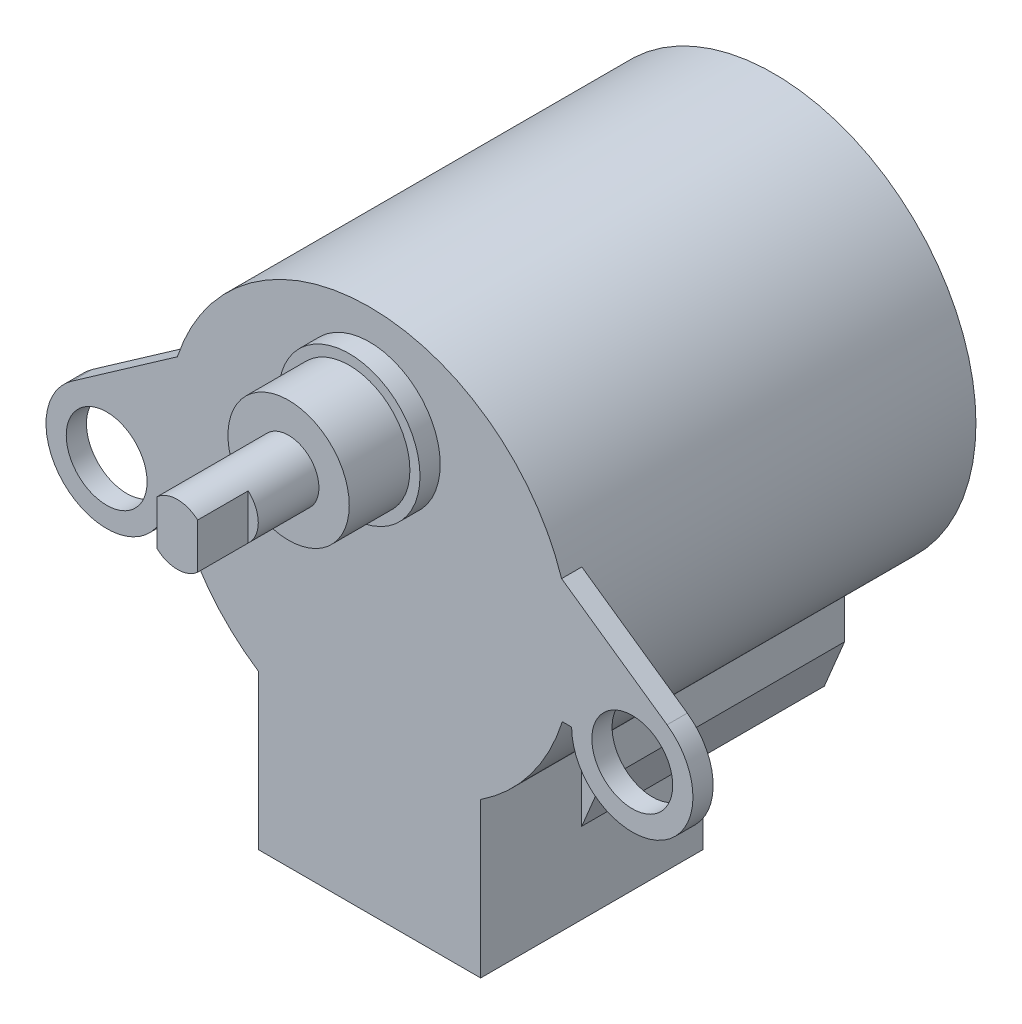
SolidWorks part; units mm, degrees
ref_plane "Plan de face" through (0, 0, 0) normal (0, 0, 1) x (1, 0, 0)
ref_plane "Plan de dessus" through (0, 0, 0) normal (0, 1, 0) x (1, 0, 0)
ref_plane "Plan de droite" through (0, 0, 0) normal (1, 0, 0) x (0, 0, -1)
sketch "Esquisse1" plane through (0, 0, 0) normal (0, 0, 1) x (1, 0, 0)
  circle A0 centre (0, 0) radius 10
  dimension "D1" = 20
extrude "Extrusion1" add sketch "Esquisse1" against normal blind 20
sketch "Esquisse2" plane through (0, 0, 0) normal (0, 0, 1) x (1, 0, 0)
  line L0 (0, 0) -> (0, -7.2576) construction
  line L3 (-5.5, -8.3516) -> (-5.5, -16)
  line L4 (-5.5, -16) -> (5.5, -16)
  line L5 (5.5, -8.3516) -> (5.5, -16)
  circle A1 centre (0, 0) radius 10
  arc A2 (-5.5, -8.3516) -> (5.5, -8.3516) centre (0, 0) ccw
  dimension "D2" = 26
  dimension "D3" = 11
  dimension "D1" = 0
extrude "Extrusion2" add sketch "Esquisse2" against normal blind 11
ref_plane "Plan1" through (0, 0, -17) normal (0, 0, -1) x (-1, 0, 0)
sketch "Esquisse4" plane through (0, 0, -17) normal (0, 0, -1) x (-1, 0, 0)
  line L0 (0, 0) -> (0, -7.603) construction
  line L1 (6.5, -9.5993) -> (6.5, -7.5993)
  line L2 (-6.5, -9.5993) -> (-5.5, -12)
  line L3 (-5.5, -12) -> (5.5, -12)
  line L4 (6.5, -9.5993) -> (5.5, -12)
  line L5 (5.5, -16) -> (-5.5, -16) construction
  line L6 (-6.5, -9.5993) -> (-6.5, -7.5993)
  circle A0 centre (0, 0) radius 10 construction
  arc A1 (-6.5, -7.5993) -> (6.5, -7.5993) centre (0, 0) ccw
  dimension "D1" = 22
  dimension "D3" = 13
  dimension "D4" = 2
extrude "Extrusion3" add sketch "Esquisse4" against normal blind 12
sketch "Esquisse5" plane through (0, 0, 0) normal (0, 0, 1) x (1, 0, 0)
  line L0 (14.7207, -0.5425) -> (9.504, 3.1102)
  line L1 (10, -3) -> (9.5394, -3)
  arc A0 (10, -3) -> (14.7207, -0.5425) centre (13, -3) ccw
  arc A1 (5.5, -8.3516) -> (-5.5, -8.3516) centre (0, 0) ccw construction
  arc A2 (9.5394, -3) -> (9.504, 3.1102) centre (0, 0) ccw
  dimension "D1" = 6
  dimension "e/2" = 13
  dimension "a" = 3
  dimension "D4" = 35
extrude "Extrusion4" add sketch "Esquisse5" against normal blind 1
sketch "Esquisse6" plane through (0, 0, 0) normal (0, 0, 1) x (1, 0, 0)
  circle A0 centre (13, -3) radius 2
  dimension "D1" = 4
extrude "Enlèv. mat.-Extru.1" cut sketch "Esquisse6" against normal up to next
mirror "Symétrie1" about plane through (0, 0, 0) normal (1, 0, 0) of "Enlèv. mat.-Extru.1", "Extrusion4"
sketch "Esquisse7" plane through (0, 0, 0) normal (0, 0, 1) x (1, 0, 0)
  circle A0 centre (0, 5) radius 3.5
  dimension "c" = 7
  dimension "b" = 5
extrude "Extrusion5" add sketch "Esquisse7" along normal blind 1
sketch "Esquisse8" plane through (0, 0, 1) normal (0, 0, 1) x (1, 0, 0)
  circle A0 centre (0, 5) radius 3
  dimension "D1" = 6
extrude "Extrusion6" add sketch "Esquisse8" along normal blind 3
sketch "Esquisse9" plane through (0, 0, 4) normal (0, 0, 1) x (1, 0, 0)
  circle A0 centre (0, 5) radius 1.5
  dimension "D1" = 3
extrude "Extrusion7" add sketch "Esquisse9" along normal blind 5.5
sketch "Esquisse10" plane through (0, 0, 9.5) normal (0, 0, 1) x (1, 0, 0)
  line L0 (0, 5) -> (0, 7.2917) construction
  line L1 (1, 6.118) -> (1, 3.882)
  line L2 (-1, 6.118) -> (-1, 3.882)
  arc A0 (1, 3.882) -> (1, 6.118) centre (0, 5) ccw
  circle A1 centre (0, 5) radius 1.5
  arc A2 (-1, 6.118) -> (-1, 3.882) centre (0, 5) ccw
  dimension "D2" = 2
  dimension "D1" = 0
extrude "Enlèv. mat.-Extru.2" cut sketch "Esquisse10" against normal blind 2.5
